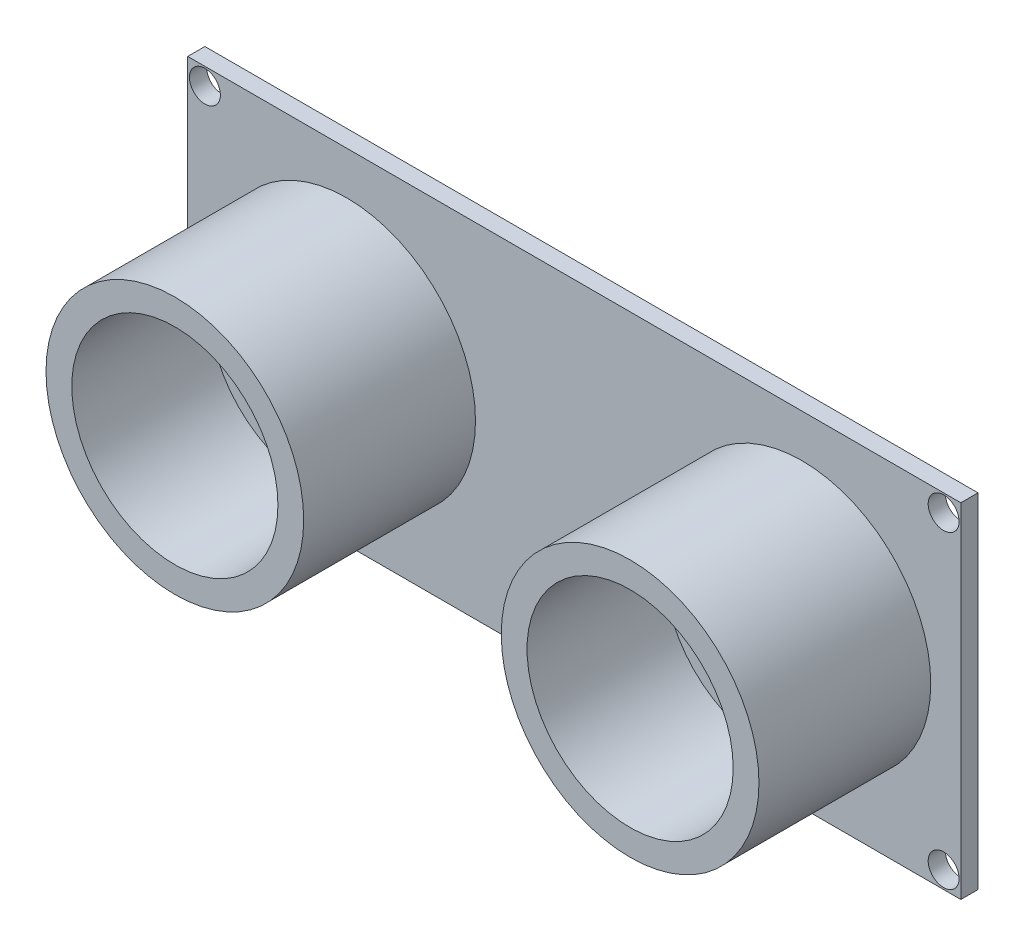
SolidWorks part; units mm, degrees
ref_plane "Piano frontale" through (0, 0, 0) normal (0, 0, 1) x (1, 0, 0)
ref_plane "Piano superiore" through (0, 0, 0) normal (0, 1, 0) x (1, 0, 0)
ref_plane "Piano destro" through (0, 0, 0) normal (1, 0, 0) x (0, 0, -1)
sketch "Schizzo1" plane through (0, 0, 0) normal (0, 0, 1) x (1, 0, 0)
  line L1 (-22.5, 10) -> (22.5, 10)
  line L2 (-22.5, 10) -> (-22.5, -10)
  line L3 (-22.5, -10) -> (22.5, -10)
  line L4 (22.5, 10) -> (22.5, -10)
  line L5 (-22.5, 10) -> (22.5, -10) construction
  line L6 (-22.5, -10) -> (22.5, 10) construction
  point P0 (0, 0)
  dimension "D1" = 45
  dimension "D2" = 20
extrude "Estrusione-Estrusione1" add sketch "Schizzo1" along normal blind 1
hole_wizard "Foro per Vite M1.6-1" positions "Schizzo2" profile "Schizzo3" hole size "M1.6" standard "ISO"
sketch "Schizzo2" plane through (0, 0, 1) normal (0, 0, 1) x (1, 0, 0)
  point P0 (-21.5, 9)
  point P2 (21.5, 9)
  point P4 (-21.5, -9)
  point P6 (21.5, -9)
sketch "Schizzo3" plane through (-21.5, 9, 1) normal (1, 0, 0) x (0, -1, 0)
  line L0 (0, 0) -> (0, 1)
  line L1 (0, 1) -> (0.9, 1)
  line L2 (0.9, 1) -> (0.9, 0)
  line L5 (0.9, 0) -> (0, 0)
  line L11 (0, -6.35) -> (0, 107.95) construction
  dimension "Thru Hole Dia." = 1.8
  dimension "Thru Hole Depth" = 1
sketch "Schizzo4" plane through (0, 0, 1) normal (0, 0, 1) x (1, 0, 0)
  circle A0 centre (-13.25, 0) radius 7.5
  circle A1 centre (13.25, 0) radius 7.5
extrude "Estrusione-Estrusione2" add sketch "Schizzo4" along normal blind 10
sketch "Schizzo5" plane through (0, 0, 11) normal (0, 0, 1) x (1, 0, 0)
  circle A0 centre (-13.25, 0) radius 6
  circle A1 centre (13.25, 0) radius 6
  dimension "D2" = 12
  dimension "D1" = 2
extrude "Taglio-Estrusione1" cut sketch "Schizzo5" against normal blind 8
sketch "Schizzo6" plane through (0, 0, 0) normal (0, 0, -1) x (-1, 0, 0)
  line L0 (22.5, -10) -> (-22.5, -10) construction
  line L1 (-2.5, -8) -> (-2, -8)
  line L2 (-2.5, -8) -> (-2.5, -15)
  line L3 (-2.5, -15) -> (-2, -15)
  line L4 (-2, -8) -> (-2, -15)
  line L5 (-1, -8) -> (-1, -15)
  line L6 (-1, -8) -> (-0.5, -8)
  line L7 (-0.5, -8) -> (-0.5, -15)
  line L8 (-1, -15) -> (-0.5, -15)
  line L9 (0, -13.5356) -> (0, -1.8771) construction
  line L10 (1, -8) -> (0.5, -8)
  line L11 (0.5, -8) -> (0.5, -15)
  line L12 (1, -15) -> (0.5, -15)
  line L13 (1, -8) -> (1, -15)
  line L14 (2.5, -15) -> (2, -15)
  line L15 (2, -8) -> (2, -15)
  line L16 (2.5, -8) -> (2, -8)
  line L17 (2.5, -8) -> (2.5, -15)
  dimension "D1" = 0.5
  dimension "D2" = 7
  dimension "D3" = 2
  dimension "D4" = 1
  dimension "D6" = 1
  dimension "D5" = 2
extrude "Estrusione-Estrusione3" add sketch "Schizzo6" along normal blind 0.5
equation "\"D4@Schizzo2\"=18/2"
equation "\"D2@Schizzo4\"=26.5/2"
